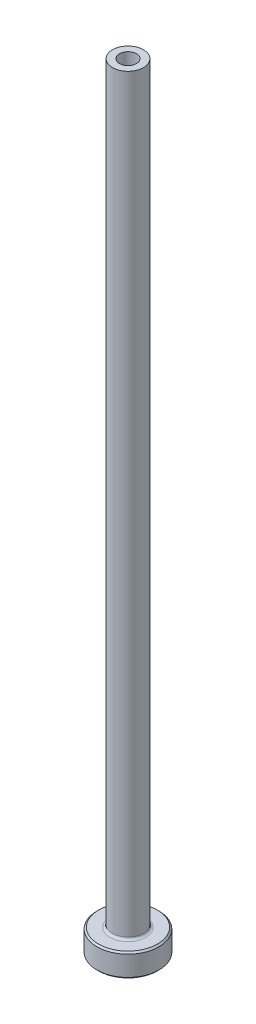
SolidWorks part; units mm, degrees
ref_plane "Front Plane" through (0, 0, 0) normal (0, 0, 1) x (1, 0, 0)
ref_plane "Top Plane" through (0, 0, 0) normal (0, 1, 0) x (1, 0, 0)
ref_plane "Right Plane" through (0, 0, 0) normal (1, 0, 0) x (0, 0, -1)
sketch "Sketch1" plane through (0, 0, 0) normal (0, 0, 1) x (1, 0, 0)
  line L0 (-1.1, 100) -> (-2, 100)
  line L1 (-2, 100) -> (-2, 3)
  line L2 (-2, 3) -> (-4, 3)
  line L3 (-4, 3) -> (-4, 0)
  line L4 (3.3, 0) -> (-3.3, 0) construction
  line L5 (-4, 0) -> (-1.35, 0)
  line L6 (-1.1, 65) -> (-1.1, 100)
  line L7 (0, 92.1877) -> (0, -15.5353) construction
  line L8 (0, -3.3) -> (0, 3.3) construction
  line L9 (-1.1, 65) -> (-1.35, 53)
  line L10 (-1.35, 53) -> (-1.35, 0)
  dimension "D1" = 0.25
  dimension "ID" = 2.2
  dimension "OD" = 4
  dimension "L" = 100
  dimension "H" = 8
  dimension "T" = 3
  dimension "N" = 35
  dimension "D2" = 12
revolve "Revolve1" add sketch "Sketch1" angle 360 about L7
fillet "Fillet1" radius 0.3 1 edges at (0, 3, 2)
chamfer "Chamfer1" distance 0.2 angle 45 2 edges at (0, 3, 4) (0, 0, 4)
chamfer "Chamfer3" distance 0.5 angle 45 1 edges at (0, 0, 1.35)
